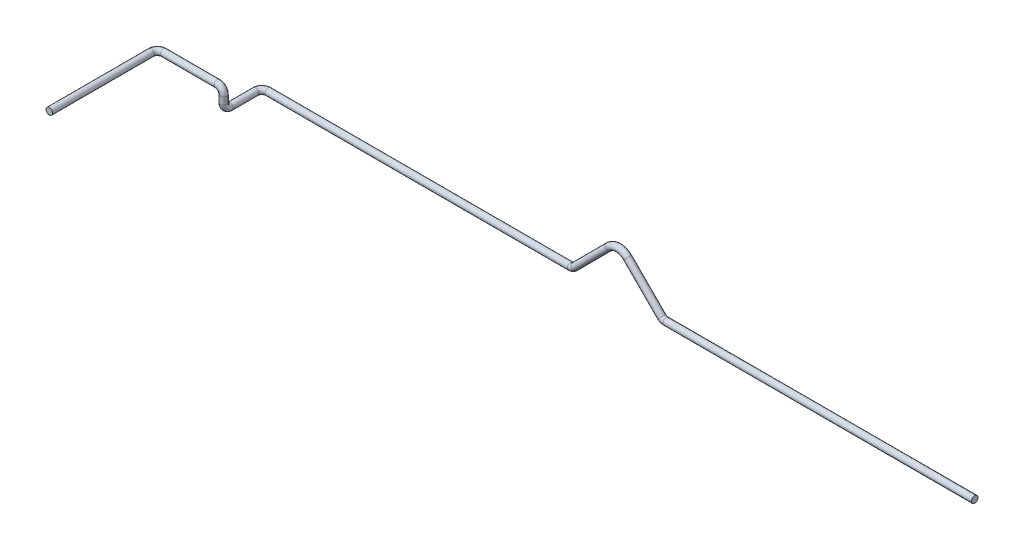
SolidWorks part; units mm, degrees
ref_plane "Front Plane" through (0, 0, 0) normal (0, 0, 1) x (1, 0, 0)
ref_plane "Top Plane" through (0, 0, 0) normal (0, 1, 0) x (1, 0, 0)
ref_plane "Right Plane" through (0, 0, 0) normal (1, 0, 0) x (0, 0, -1)
sketch "Sketch1" plane through (0, 0, 0) normal (0, 0, 1) x (1, 0, 0)
  line L0 (0, 0) -> (0, 10.8994) construction
  line L1 (-2.2493, 8.6416) -> (-10.4118, 0.4484)
  line L2 (-11.4914, 0) -> (-85.725, 0)
  line L3 (11.4914, 0) -> (85.725, 0)
  line L4 (2.2493, 8.6416) -> (10.4118, 0.4484)
  arc A0 (2.2493, 8.6416) -> (-2.2493, 8.6416) centre (0, 6.4008) ccw
  arc A1 (11.4914, 0) -> (10.4118, 0.4484) centre (11.4914, 1.524) cw
  arc A2 (-10.4118, 0.4484) -> (-11.4914, 0) centre (-11.4914, 1.524) cw
  point P12 (10.8585, 0)
  point P15 (-10.8585, 0)
  dimension "D1" = 3.175
  dimension "D4" = 1.524
  dimension "D2" = 9.5758
  dimension "D3" = 21.717
  dimension "D5" = 85.725
sketch "Sketch2" plane through (0, 0, 0) normal (0, 1, 0) x (1, 0, 0)
  line L0 (-85.725, 0) -> (-85.725, -9.1948)
  line L1 (-11.4914, 0) -> (-85.725, 0) construction
  dimension "D1" = 9.1948
sketch3d "3DSketch1"
  line L0 (-11.4914, 0, 0) -> (-85.725, 0, 0) construction
  line L1 (-85.725, 0, 0) -> (-85.725, 0, 9.1948) construction
  line L2 (-2.2493, 8.6416, 0) -> (-10.4118, 0.4484, 0) construction
  line L3 (2.2493, 8.6416, 0) -> (10.4118, 0.4484, 0) construction
  line L4 (11.4914, 0, 0) -> (85.725, 0, 0) construction
  line L5 (-11.4914, 0, 0) -> (-84.201, 0, 0)
  line L6 (-85.725, 0, 1.524) -> (-85.725, 0, 7.6708)
  line L7 (-2.2493, 8.6416, 0) -> (-10.4118, 0.4484, 0)
  line L8 (2.2493, 8.6416, 0) -> (10.4118, 0.4484, 0)
  line L9 (11.4914, 0, 0) -> (85.725, 0, 0)
  line L10 (-85.725, 1.524, 9.1948) -> (-85.725, 3.2385, 9.1948)
  line L11 (-87.249, 4.7625, 9.1948) -> (-100.1268, 4.7625, 9.1948)
  line L12 (-101.6508, 4.7625, 10.7188) -> (-101.6508, 4.7625, 35.2044)
  arc A0 (-10.4118, 0.4484, 0) -> (-11.4914, 0, 0) centre (-11.4914, 1.524, 0) ccw construction
  arc A1 (2.2493, 8.6416, 0) -> (-2.2493, 8.6416, 0) centre (0, 6.4008, 0) ccw construction
  arc A2 (11.4914, 0, 0) -> (10.4118, 0.4484, 0) centre (11.4914, 1.524, 0) ccw construction
  arc A3 (-10.4118, 0.4484, 0) -> (-11.4914, 0, 0) centre (-11.4914, 1.524, 0) ccw
  arc A4 (2.2493, 8.6416, 0) -> (-2.2493, 8.6416, 0) centre (0, 6.4008, 0) ccw
  arc A5 (11.4914, 0, 0) -> (10.4118, 0.4484, 0) centre (11.4914, 1.524, 0) ccw
  arc A6 (-100.1268, 4.7625, 9.1948) -> (-101.6508, 4.7625, 10.7188) centre (-100.1268, 4.7625, 10.7188) ccw
  arc A7 (-84.201, 0, 0) -> (-85.725, 0, 1.524) centre (-84.201, 0, 1.524) ccw
  arc A8 (-85.725, 3.2385, 9.1948) -> (-87.249, 4.7625, 9.1948) centre (-87.249, 3.2385, 9.1948) ccw
  arc A9 (-85.725, 0, 7.6708) -> (-85.725, 1.524, 9.1948) centre (-85.725, 1.524, 7.6708) ccw
  point P6 (-11.4914, 1.524, -1.524)
  point P10 (0, 6.4008, 3.175)
  point P14 (-11.4914, 1.524, -1.524)
  point P15 (0, 6.4008, 3.175)
  point P16 (11.4914, 1.524, -1.524)
  point P17 (11.4914, 1.524, -1.524)
  point P23 (-101.6508, 4.7625, 9.1948)
  point P24 (-100.1268, 6.2865, 10.7188)
  point P27 (-85.725, 0, 0)
  point P29 (-84.201, 1.524, 1.524)
  point P32 (-85.725, 4.7625, 9.1948)
  point P33 (-87.249, 3.2385, 10.7188)
  point P36 (-85.725, 0, 9.1948)
  point P38 (-87.249, 1.524, 7.6708)
  dimension "D4" = 1.524
  dimension "D1" = 4.7625
  dimension "D2" = 15.9258
  dimension "D3" = 26.0096
ref_plane "Plane1" through (-101.6508, 4.7625, 35.2044) normal (0, 0, 1) x (1, 0, 0)
sketch "Sketch3" plane through (-101.6508, 4.7625, 35.2044) normal (0, 0, 1) x (1, 0, 0)
  circle A0 centre (0, 0) radius 0.7874
  dimension "D1" = 1.5748
sweep "Sweep1" add profiles "Sketch3" path "3DSketch1"
